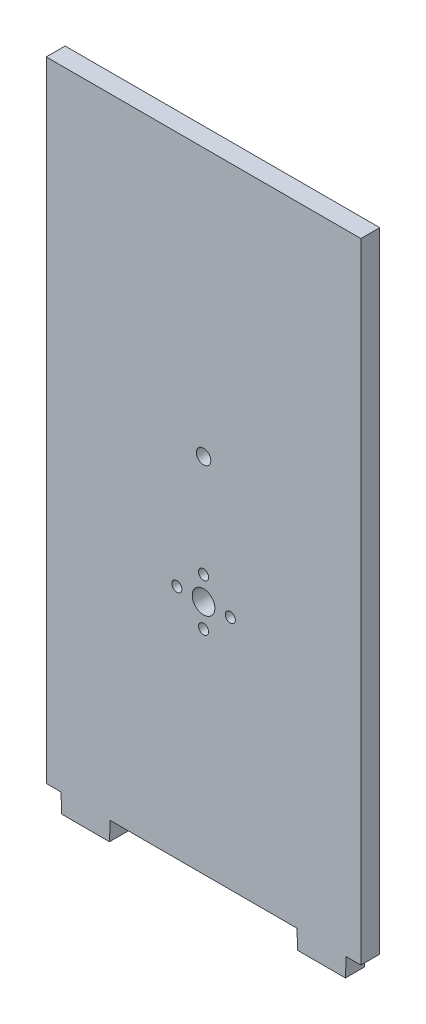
SolidWorks part; units mm, degrees
ref_plane "Front" through (0, 0, 0) normal (0, 0, 1) x (1, 0, 0)
ref_plane "Top" through (0, 0, 0) normal (0, 1, 0) x (1, 0, 0)
ref_plane "Right" through (0, 0, 0) normal (1, 0, 0) x (0, 0, -1)
sketch "Sketch1" plane through (0, 0, 0) normal (0, 0, 1) x (1, 0, 0)
  line L0 (-50, -100) -> (50, 100) construction
  line L1 (-50, -100) -> (50, -100)
  line L2 (-50, -100) -> (-50, 100)
  line L3 (-50, 100) -> (50, 100)
  line L4 (50, -100) -> (50, 100)
  dimension "D1" = 200
  dimension "D2" = 100
extrude "Boss-Extrude1" add sketch "Sketch1" along normal blind 6
sketch "Sketch2" plane through (0, 0, 6) normal (0, 0, 1) x (1, 0, 0)
  line L0 (0, 0) -> (0, -100) construction
  line L1 (-50, -100) -> (50, -100) construction
  line B0 (-37.5, -106) -> (-37.5, -100) construction
  line B1 (-29.6905, -100) -> (-45.3095, -100)
  line B2 (-45.3095, -100) -> (-45.1, -106)
  line B3 (-45.1, -106) -> (-29.9, -106)
  line B4 (-29.6905, -100) -> (-29.9, -106)
  line B5 (37.5, -106) -> (37.5, -100) construction
  line B6 (45.3095, -100) -> (29.6905, -100)
  line B7 (29.6905, -100) -> (29.9, -106)
  line B8 (29.9, -106) -> (45.1, -106)
  line B9 (45.3095, -100) -> (45.1, -106)
  dimension "D1" = 75
sketch_block_instance "Block-laser-cut-tab-15x6-1"
sketch_block "Block-laser-cut-tab-15x6" parameters "D1"=6, "D2"=15.2, "D3"=88
sketch_block_instance "Block-laser-cut-tab-15x6-3"
extrude "tabs" add sketch "Sketch2" against normal up to surface (6 mm away)
sketch "Sketch5" plane through (0, 0, 6) normal (0, 0, 1) x (1, 0, 0)
  line L0 (0, 100) -> (0, -100) construction
  line L1 (50, 100) -> (-50, 100) construction
  line L2 (-29.6905, -100) -> (29.6905, -100) construction
  line L3 (-50, -25) -> (50, -25) construction
  circle A5 centre (0, -25) radius 3.6
  circle A6 centre (0, -17.5) radius 1.6
  circle A7 centre (0, -32.5) radius 1.6
  circle A8 centre (8.5, -25) radius 1.6
  circle A9 centre (-8.5, -25) radius 1.6
  circle A10 centre (0, 15) radius 2.3
  dimension "D1" = 3.2
  dimension "D2" = 3.2
  dimension "D3" = 7.2
  dimension "D9" = 4.6
  dimension "D4" = 17
  dimension "D5" = 15
  dimension "D6" = 75
  dimension "D7" = 0
  dimension "D8" = 0
  dimension "D10" = 40
extrude "axle holes" cut sketch "Sketch5" against normal blind 6
